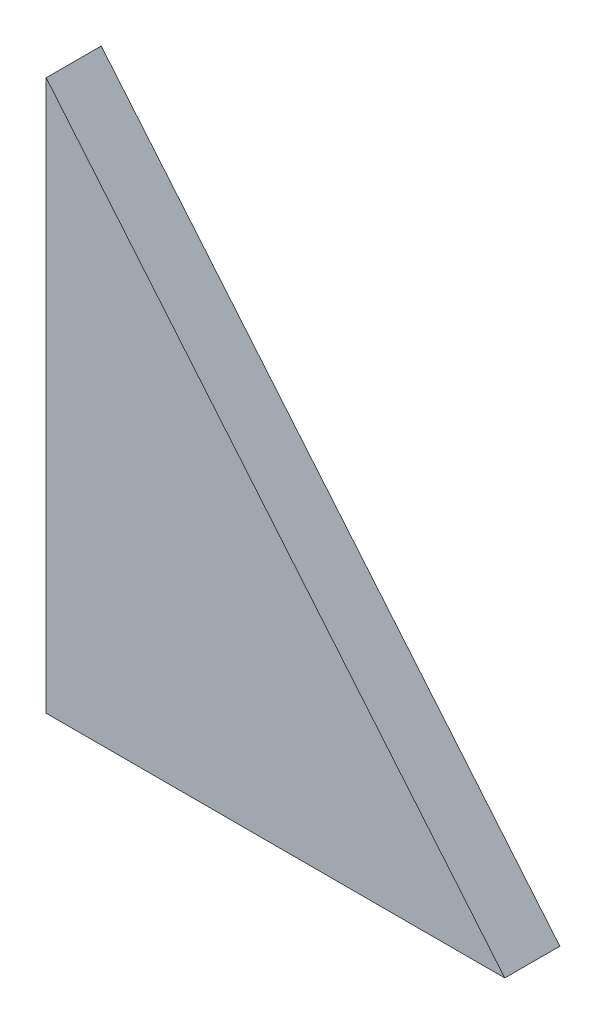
SolidWorks part; units mm, degrees
ref_plane "前视基准面" through (0, 0, 0) normal (0, 0, 1) x (1, 0, 0)
ref_plane "上视基准面" through (0, 0, 0) normal (0, 1, 0) x (1, 0, 0)
ref_plane "右视基准面" through (0, 0, 0) normal (1, 0, 0) x (0, 0, -1)
sketch "草图1" plane through (0, 0, 0) normal (0, 0, 1) x (1, 0, 0)
  line L0 (0, 60) -> (0, 0)
  line L1 (0, 0) -> (50, 0)
  line L2 (50, 0) -> (0, 60)
  dimension "D1" = 60
  dimension "D2" = 50
extrude "拉伸1" add sketch "草图1" along normal blind 6
